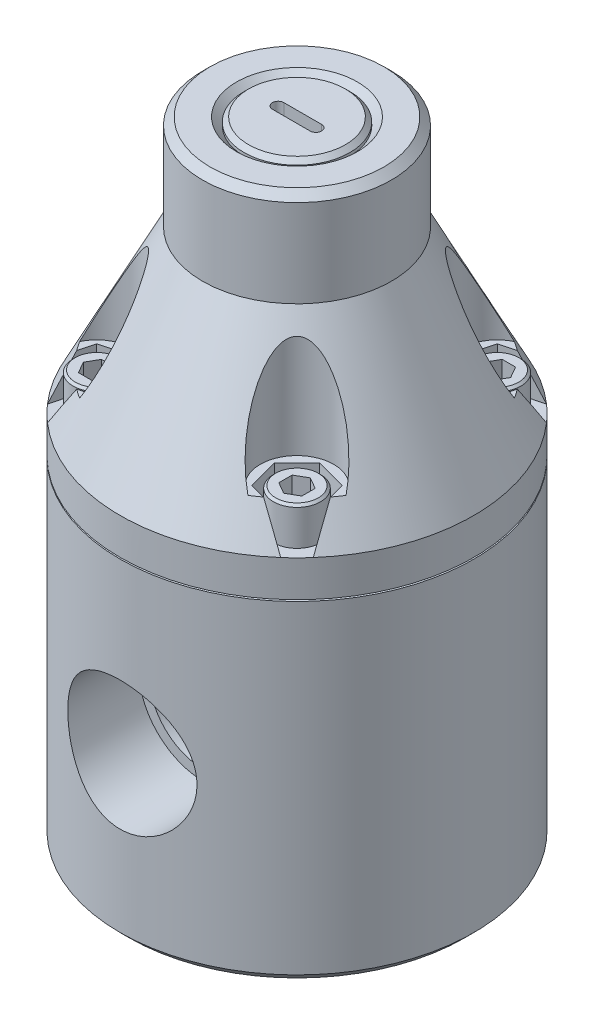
SolidWorks part; units mm, degrees
ref_plane "Front Plane" through (0, 0, 0) normal (0, 0, 1) x (1, 0, 0)
ref_plane "Top Plane" through (0, 0, 0) normal (0, 1, 0) x (1, 0, 0)
ref_plane "Right Plane" through (0, 0, 0) normal (1, 0, 0) x (0, 0, -1)
sketch "Sketch1" plane through (0, 0, 0) normal (0, 1, 0) x (1, 0, 0)
  circle A0 centre (0, 0) radius 29.718
  dimension "D1" = 59.436
extrude "Extrude1" add sketch "Sketch1" along normal blind 105.41
sketch "Sketch2" plane through (0, 0, 0) normal (0, 0, 1) x (1, 0, 0)
  line L0 (0, 0) -> (0, 105.41) construction
  line L1 (29.718, 105.41) -> (-29.718, 105.41) construction
  line L2 (-29.718, 55.88) -> (-20.6255, 55.88)
  line L3 (-29.718, 105.41) -> (-29.718, 0) construction
  line L4 (-20.6255, 55.88) -> (-20.6255, 56.134)
  line L5 (-20.6255, 56.134) -> (-29.718, 56.134)
  line L6 (-29.718, 56.134) -> (-29.718, 62.23)
  line L7 (-29.718, 62.23) -> (-15.875, 89.408)
  line L8 (-15.875, 89.408) -> (-15.875, 105.41)
  line L9 (-15.875, 105.41) -> (-21.1252, 108.0842)
  line L10 (-21.1252, 108.0842) -> (-34.3087, 108.0842)
  line L11 (-34.3087, 108.0842) -> (-34.3087, 59.0996)
  line L12 (-34.3087, 59.0996) -> (-29.718, 55.88)
  line L13 (-29.718, 0) -> (29.718, 0) construction
  dimension "D1" = 55.88
  dimension "D2" = 0.254
  dimension "D3" = 29.718
  dimension "D4" = 6.35
  dimension "D5" = 27.178
  dimension "D6" = 15.875
revolve "Cut-Revolve1" cut sketch "Sketch2" angle 360 about L0
ref_plane "Plane1" through (0, 105.41, 0) normal (0, 1, 0) x (-1, 0, 0)
sketch "Sketch3" plane through (0, 105.41, 0) normal (0, 1, 0) x (-1, 0, 0)
  circle A0 centre (0, 0) radius 10.16
  dimension "D1" = 20.32
extrude "Extrude2" cut sketch "Sketch3" against normal blind 1.27 draft 45
ref_plane "Plane2" through (0, 0, 29.718) normal (0, 0, 1) x (1, 0, 0)
sketch "Sketch4" plane through (0, 0, 29.718) normal (0, 0, 1) x (1, 0, 0)
  line L0 (0, 0) -> (0, 55.88) construction
  line L1 (29.718, 55.88) -> (-29.718, 55.88) construction
  line L2 (29.718, 27.432) -> (-29.718, 27.432) construction
  line L6 (29.718, 0) -> (29.718, 55.88) construction
  line L7 (-29.718, 55.88) -> (-29.718, 0) construction
  line L8 (-29.718, 0) -> (29.718, 0) construction
  dimension "D1" = 27.432
hole_wizard "CBORE for #00 Binding Head Machine Screw1" positions "3DSketch1" profile "Sketch5" counterbore size "#00" standard "Ansi Inch"
sketch3d "3DSketch1"
  line L0 (29.718, 27.432, 29.718) -> (-29.718, 27.432, 29.718) construction
  point P0 (0, 27.432, 29.718)
  point P5 (0, 27.432, 29.718)
sketch "Sketch5" plane through (0, 27.432, 29.718) normal (1, 0, 0) x (0, -1, 0)
  line L0 (0, 0) -> (0, 20.5484)
  line L1 (0, 20.5484) -> (9.1186, 16.002)
  line L2 (9.1186, 16.002) -> (9.1186, 13.97)
  line L3 (9.1186, 13.97) -> (10.8585, 13.97)
  line L4 (10.8585, 13.97) -> (10.8585, 0)
  line L5 (10.8585, 0) -> (0, 0)
  line L10 (0, 20.5484) -> (-9.1186, 16.002) construction
  line L11 (0, -6.35) -> (0, 107.95) construction
  dimension "Hole Dia." = 18.2372
  dimension "Hole Depth" = 16.002
  dimension "C'Bore Dia." = 21.717
  dimension "C'Bore Depth" = 13.97
  dimension "Drill Angle" = 127
pattern_circular "CirPattern1" count 2 over 360 about axis through (0, 105.41, 0) along (0, -1, 0) of "CBORE for #00 Binding Head Machine Screw1"
chamfer "Chamfer1" distance 1.27 angle 45 1 edges at (0, 105.41, -15.875)
chamfer "Chamfer2" distance 1.524 angle 45 1 edges at (0, 0, 29.718)
sketch "Sketch6" plane through (0, 105.41, 0) normal (0, 1, 0) x (-1, 0, 0)
  circle A0 centre (0, 0) radius 8.89
extrude "Extrude3" add sketch "Sketch6" against normal up to surface (1.27 mm away)
chamfer "Chamfer3" distance 0.762 angle 45 1 edges at (0, 105.41, 8.89)
sketch "Sketch7" plane through (0, 105.41, 0) normal (0, 1, 0) x (-1, 0, 0)
  line L0 (0, 0) -> (-3.175, 0) construction
  line L1 (-3.175, 0.9652) -> (3.175, 0.9652)
  line L2 (3.175, -0.9652) -> (-3.175, -0.9652)
  arc A0 (-3.175, 0.9652) -> (-3.175, -0.9652) centre (-3.175, 0) ccw
  arc A1 (3.175, -0.9652) -> (3.175, 0.9652) centre (3.175, 0) ccw
  dimension "D1" = 3.175
  dimension "D2" = 6.35
  dimension "D3" = 0.9652
  dimension "D4" = 0.9652
extrude "Extrude4" cut sketch "Sketch7" against normal blind 4.7498
ref_plane "Plane3" through (0, 68.58, 0) normal (0, 1, 0) x (-1, 0, 0)
sketch "Sketch8" plane through (0, 68.58, 0) normal (0, 1, 0) x (-1, 0, 0)
  line L0 (0, 0) -> (0, -29.718) construction
  line L1 (0, 0) -> (-21.0138, -21.0138) construction
  circle A1 centre (0, 0) radius 29.718 construction
  circle A2 centre (0, 0) radius 23.8125 construction
  circle A3 centre (-16.838, -16.838) radius 6.1722
  dimension "D2" = 47.625
  dimension "D3" = 12.3444
  dimension "D1" = 45
extrude "Extrude5" cut sketch "Sketch8" along normal blind 21.0058
pattern_circular "CirPattern2" count 4 over 360 about axis through (0, 0, 0) along (0, 1, 0) of "Extrude5"
sketch "Sketch9" plane through (0, 68.58, 0) normal (0, 1, 0) x (-1, 0, 0)
  line L0 (0, 0) -> (0, -29.718) construction
  line L1 (0, 0) -> (-21.0138, -21.0138) construction
  line L2 (-16.838, -16.838) -> (-21.0138, -12.6622) construction
  line L5 (-20.6332, -13.0427) -> (-23.298, -23.298)
  line L7 (-13.0427, -20.6332) -> (-11.6536, -15.4488)
  line L8 (-11.6536, -15.4488) -> (-15.4488, -11.6536)
  line L9 (-15.4488, -11.6536) -> (-20.6332, -13.0427)
  line L10 (-22.0224, -18.2271) -> (-18.2271, -22.0224)
  line L11 (-23.298, -23.298) -> (-13.0427, -20.6332)
  line L13 (-20.6332, -13.0427) -> (-22.0224, -18.2271)
  line L14 (-18.2271, -22.0224) -> (-13.0427, -20.6332)
  circle A0 centre (0, 0) radius 29.718 construction
  circle A1 centre (0, 0) radius 23.8125 construction
  circle A2 centre (-16.838, -16.838) radius 4.6482 construction
  circle A3 centre (-16.838, -16.838) radius 4.6482 construction
  dimension "D1" = 9.2964
extrude "Extrude6" cut sketch "Sketch9" against normal blind 6.35
pattern_circular "CirPattern3" count 4 over 360 about axis through (0, 0, 0) along (0, 1, 0) of "Extrude6"
sketch "Sketch10" plane through (0, 68.58, 0) normal (0, 1, 0) x (-1, 0, 0)
  circle A0 centre (-16.838, -16.838) radius 3.9624
  dimension "D1" = 7.9248
extrude "Extrude7" add sketch "Sketch10" against normal up to surface (6.35 mm away)
sketch "Sketch11" plane through (0, 68.58, 0) normal (0, 1, 0) x (-1, 0, 0)
  line L1 (-19.0755, -16.838) -> (-17.9568, -18.7758)
  line L2 (-17.9568, -18.7758) -> (-15.7192, -18.7758)
  line L3 (-15.7192, -18.7758) -> (-14.6004, -16.838)
  line L4 (-14.6004, -16.838) -> (-15.7192, -14.9002)
  line L5 (-15.7192, -14.9002) -> (-17.9568, -14.9002)
  line L6 (-17.9568, -14.9002) -> (-19.0755, -16.838)
  circle A0 centre (-16.838, -16.838) radius 1.9378 construction
extrude "Extrude8" cut sketch "Sketch11" against normal blind 3.175
pattern_circular "CirPattern4" count 4 over 360 about axis through (0, 0, 0) along (0, 1, 0) of "Extrude7", "Extrude8"
chamfer "Chamfer5" distance 0.381 angle 45 4 edges at (16.838, 68.58, -12.8756) (12.8756, 68.58, 16.838) (-16.838, 68.58, 12.8756) (-12.8756, 68.58, -16.838)
